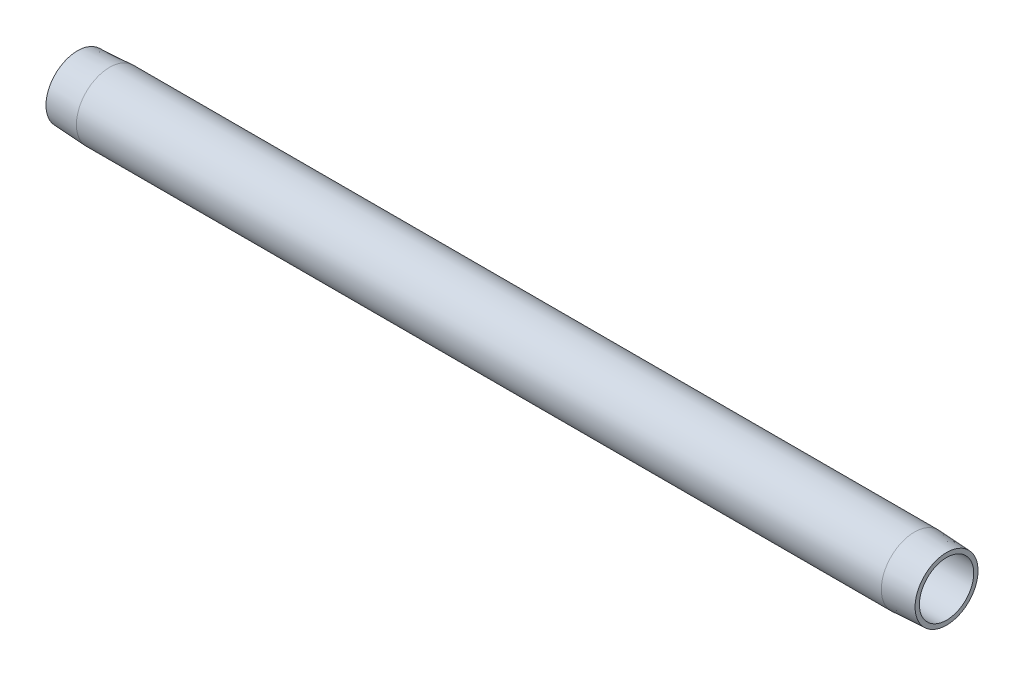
SolidWorks part; units mm, degrees
ref_plane "Front Plane" through (0, 0, 0) normal (0, 0, 1) x (1, 0, 0)
ref_plane "Top Plane" through (0, 0, 0) normal (0, 1, 0) x (1, 0, 0)
ref_plane "Right Plane" through (0, 0, 0) normal (1, 0, 0) x (0, 0, -1)
sketch "Sketch1" plane through (0, 0, 0) normal (0, 0, 1) x (1, 0, 0)
  line L6 (279.4, 8.7313) -> (0, 8.7313)
  line L7 (10.3124, 10.668) -> (0, 10.1276)
  line L8 (269.0876, 10.668) -> (10.3124, 10.668)
  line L9 (279.4, 10.1276) -> (269.0876, 10.668)
  line L10 (279.4, 8.7313) -> (279.4, 10.1276)
  line L11 (0, 10.1276) -> (0, 8.7313)
  line L12 (0, 0) -> (50000, 0) construction
  line L13 (0, -55) -> (0, 55) construction
  dimension "D1" = 279.4
  dimension "D2" = 3
  dimension "D3" = 3
  dimension "D4" = 21.336
  dimension "D5" = 17.4625
  dimension "D6" = 10.3124
  dimension "D7" = 10.3124
revolve "Revolve1" add sketch "Sketch1" angle 360 about L12
